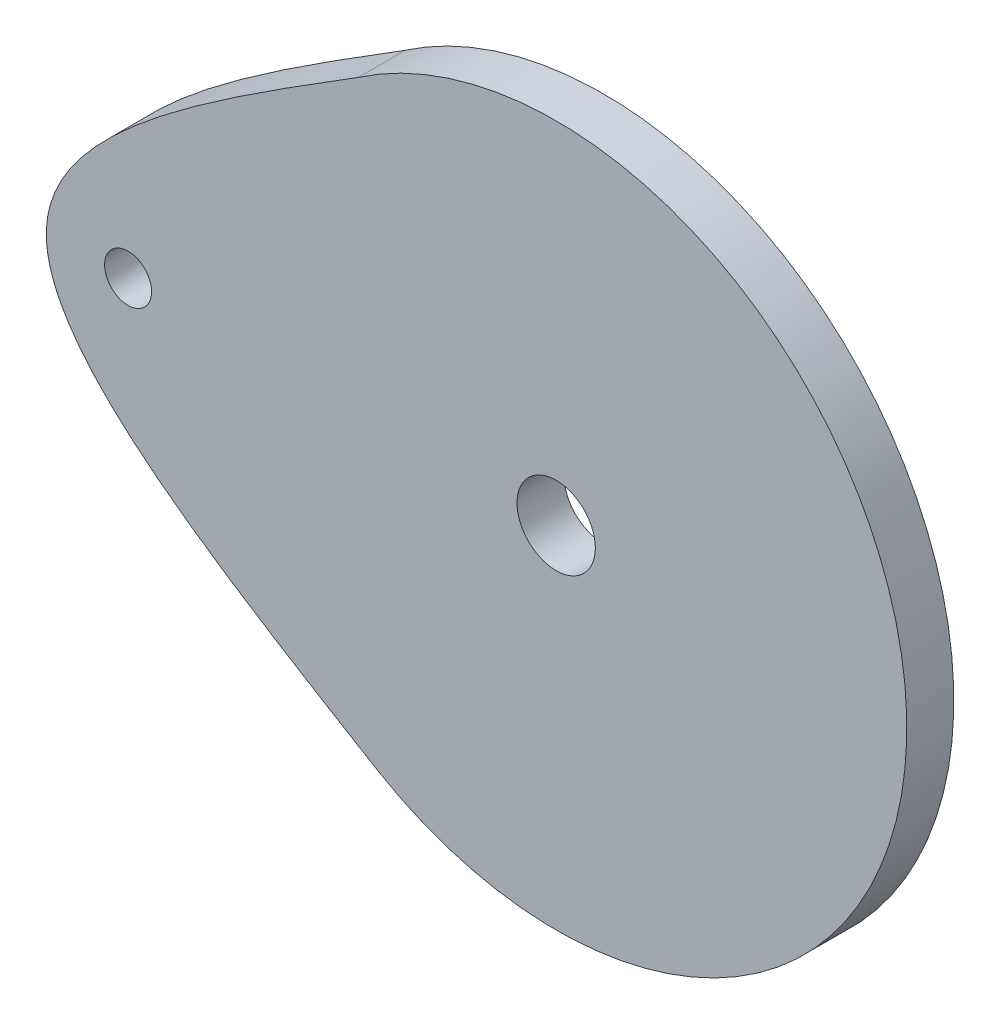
SolidWorks part; units mm, degrees
ref_plane "Plan de face" through (0, 0, 0) normal (0, 0, 1) x (1, 0, 0)
ref_plane "Plan de dessus" through (0, 0, 0) normal (0, 1, 0) x (1, 0, 0)
ref_plane "Plan de droite" through (0, 0, 0) normal (1, 0, 0) x (0, 0, -1)
sketch "Esquisse1" plane through (0, 0, 0) normal (0, 0, 1) x (1, 0, 0)
  arc A0 (-11.2554, -19.321) -> (-12.6294, 18.4508) centre (0.0125, -0.0002) ccw
  circle A1 centre (0, 0) radius 2.5
  circle A2 centre (-27.32, 0) radius 1.5
  spline S0 degree 3 poles (-12.6294, 18.4508) (-22.5049, 12.2839) (-42.8384, -0.4136) (-21.9822, -12.8993) (-11.2554, -19.321) knots 0 0 0 0 0.48568 1 1 1 1
extrude "Extrusion1" add sketch "Esquisse1" along normal blind 3
